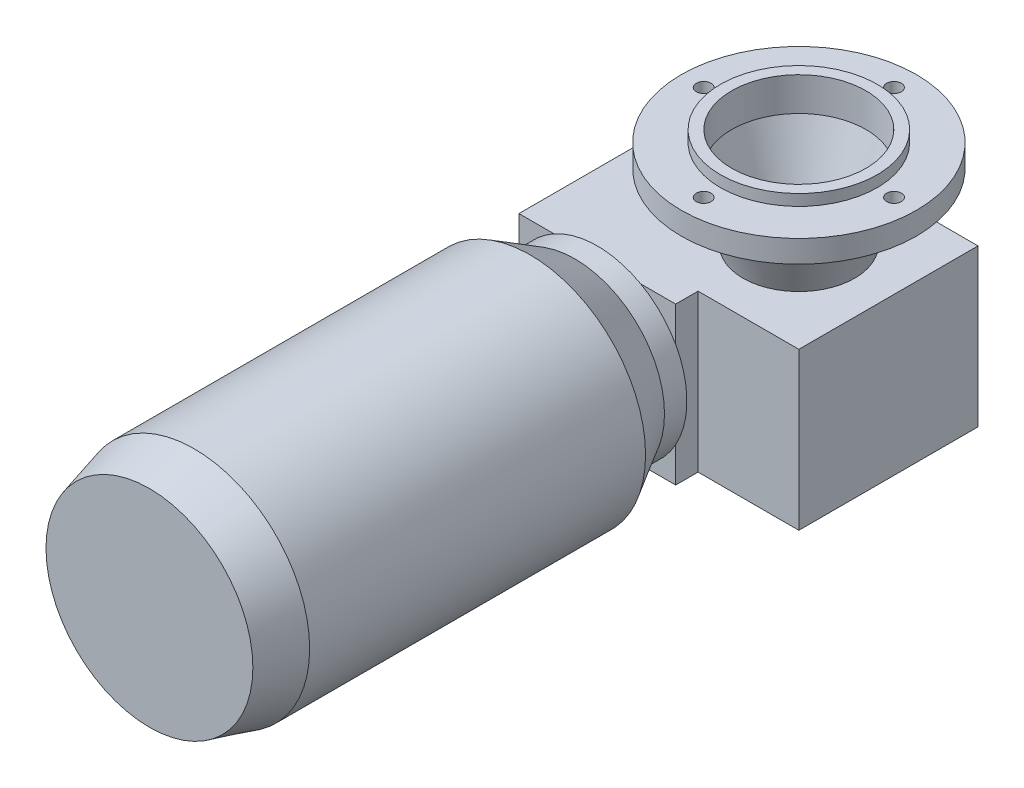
SolidWorks part; units mm, degrees
ref_plane "Plan1" through (0, 0, 0) normal (0, 0, 1) x (1, 0, 0)
ref_plane "Plan2" through (0, 0, 0) normal (0, 1, 0) x (1, 0, 0)
ref_plane "Plan3" through (0, 0, 0) normal (1, 0, 0) x (0, 0, -1)
sketch "Esquisse1" plane through (0, 0, 0) normal (0, 0, 1) x (1, 0, 0)
  line L0 (0, 32.3842) -> (0, -81.6496) construction
  line L1 (30, 0) -> (35, 0)
  line L2 (35, 0) -> (35, -5)
  line L3 (35, -5) -> (52.5, -5)
  line L4 (52.5, -5) -> (52.5, -15)
  line L5 (52.5, -15) -> (35.8, -15)
  line L6 (30, 0) -> (30, -15)
  line L7 (25, -45) -> (0, -45)
  line L8 (0, -40) -> (0, -45)
  line L9 (0, -40) -> (21, -40)
  line L10 (30, -15) -> (21, -40)
  line L11 (25, -45) -> (35.8, -15)
  dimension "D1" = 35
  dimension "D2" = 52.5
  dimension "D3" = 25
  dimension "D4" = 35
  dimension "D5" = 10
  dimension "D6" = 5
  dimension "D7" = 21
  dimension "D8" = 5
  dimension "D9" = 40
  dimension "D10" = 15
revolve "Base-Révolution" add sketch "Esquisse1" angle 360 about L0
hole_wizard "Perçage1" positions "Esquisse4" profile "Esquisse3" hole size "M6" standard "ISO"
sketch "Esquisse4" plane through (0, -5, 0) normal (0, 1, 0) x (-1, 0, 0)
  circle A0 centre (0, 0) radius 35 construction
  point P0 (42.5, 0)
  point P1 (-42.5, 0)
  point P2 (0, -42.5)
  point P3 (0, 42.5)
  dimension "D1" = 42.5
  dimension "D2" = 42.5
  dimension "D3" = 42.5
  dimension "D4" = 42.5
sketch "Esquisse3" plane through (-42.5, -5, 0) normal (1, 0, 0) x (0, 0, 1)
  line L0 (0, 0) -> (0, 10)
  line L1 (0, 10) -> (3.3, 10)
  line L2 (3.3, 10) -> (3.3, 0)
  line L5 (3.3, 0) -> (0, 0)
  line L11 (0, -6.35) -> (0, 107.95) construction
  dimension "Diamètre du perçage jusqu'au prochain" = 6.6
  dimension "Profondeur du perçage jusqu'au prochain" = 10
sketch "Esquisse2" plane through (0, -45, 0) normal (0, -1, 0) x (1, 0, 0)
  line L0 (-5, -40) -> (-5, -60)
  line L1 (-5, -40) -> (40, -40)
  line L2 (-75, -60) -> (-75, 50)
  line L3 (40, 40) -> (-5, 40)
  line L4 (40, -40) -> (40, 40)
  line L5 (-5, -60) -> (-75, -60)
  line L6 (-5, 40) -> (-5, 50)
  line L7 (-5, 50) -> (-75, 50)
  circle A1 centre (0, 0) radius 35 construction
  point P9 (-5, 40)
  point P15 (40, -40)
  point P16 (40, -40)
  point P21 (40, 40)
  point P24 (-5, 50)
  point P27 (-75, 50)
  dimension "D5" = 40
  dimension "D1" = 40
  dimension "D2" = 5
  dimension "D4" = 5
  dimension "D3" = 80
  dimension "D6" = 10
  dimension "D7" = 70
  dimension "D8" = 110
extrude "Boss.-Extru.1" add sketch "Esquisse2" along normal blind 70
sketch "Esquisse6" plane through (0, 0, 50) normal (0, 0, 1) x (1, 0, 0)
  line L1 (-5, -45) -> (-75, -45) construction
  line L3 (-75, -115) -> (-75, -45) construction
  circle A0 centre (-40, -80) radius 40
  dimension "D1" = 80
  dimension "D2" = 35
  dimension "D3" = 35
extrude "Boss.-Extru.2" add sketch "Esquisse6" along normal blind 10
sketch "Esquisse7" plane through (0, 0, 60) normal (0, 0, 1) x (1, 0, 0)
  circle A0 centre (-40, -80) radius 40
  circle A1 centre (-40, -80) radius 40 construction
extrude "Boss.-Extru.3" add sketch "Esquisse7" along normal blind 20 draft 30
sketch "Esquisse8" plane through (0, 0, 80) normal (0, 0, 1) x (1, 0, 0)
  circle A0 centre (-40, -80) radius 51.547
  circle A1 centre (-40, -80) radius 51.547 construction
extrude "Boss.-Extru.4" add sketch "Esquisse8" along normal blind 150
sketch "Esquisse9" plane through (0, 0, 230) normal (0, 0, 1) x (1, 0, 0)
  circle A0 centre (-40, -80) radius 51.547
  circle A1 centre (-40, -80) radius 51.547 construction
extrude "Boss.-Extru.5" add sketch "Esquisse9" along normal blind 20 draft 15
sketch "Esquisse10" plane through (0, -115, 0) normal (0, -1, 0) x (1, 0, 0)
  line L0 (-5, -40) -> (40, -40) construction
  line L1 (40, -40) -> (40, 40) construction
  circle A0 centre (0, 0) radius 20
  dimension "D1" = 40
  dimension "D2" = 40
  dimension "D3" = 40
extrude "Boss.-Extru.6" add sketch "Esquisse10" along normal blind 5
